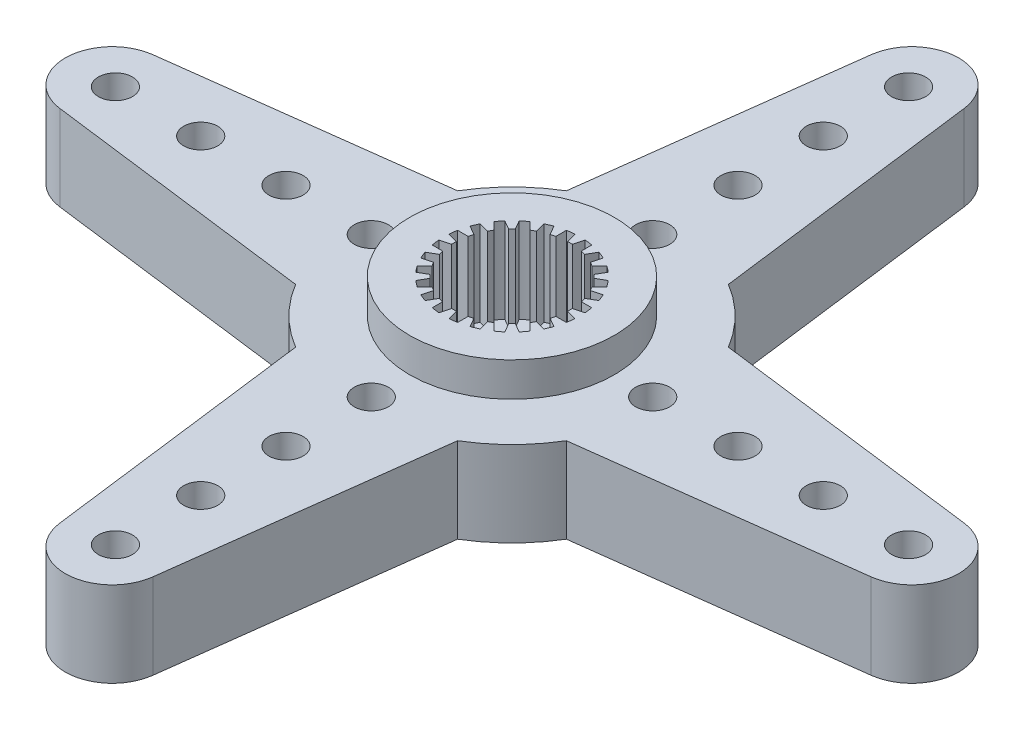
SolidWorks part; units mm, degrees
ref_plane "Plan de face" through (0, 0, 0) normal (0, 0, 1) x (1, 0, 0)
ref_plane "Plan de dessus" through (0, 0, 0) normal (0, 1, 0) x (1, 0, 0)
ref_plane "Plan de droite" through (0, 0, 0) normal (1, 0, 0) x (0, 0, -1)
sketch "Esquisse1" plane through (0, 0, 0) normal (0, 1, 0) x (1, 0, 0)
  circle A0 centre (0, 0) radius 9.25
  circle A1 centre (0, 0) radius 1.65
  dimension "D1" = 18.5
  dimension "D2" = 3.3
extrude "Boss.-Extru.1" add sketch "Esquisse1" along normal blind 8
sketch "Esquisse2" plane through (0, 8, 0) normal (0, 1, 0) x (1, 0, 0)
  line L0 (-4.75, 7.9373) -> (-2.7279, 23.7853)
  line L1 (2.7279, 23.7853) -> (4.75, 7.9373)
  line L2 (4.75, 7.9373) -> (-4.75, 7.9373)
  line L3 (-9.6717, 26.1873) -> (9.6602, 26.1873) construction
  circle A0 centre (0, 0) radius 9.25 construction
  arc A1 (-2.7279, 23.7853) -> (2.7279, 23.7853) centre (0, 23.4373) cw
  dimension "D3" = 2.75
  dimension "D1" = 9.5
  dimension "D2" = 18.25
extrude "Boss.-Extru.2" add sketch "Esquisse2" against normal up to surface (8 mm away)
pattern_circular "Répétition circulaire1" count 4 over 360 about axis through (0, 0, 0) along (0, 1, 0) of "Boss.-Extru.2"
sketch "Esquisse3" plane through (0, 8, 0) normal (0, 1, 0) x (1, 0, 0)
  line L0 (0, 0) -> (0, 17.0578) construction
  circle A0 centre (0, 8.25) radius 1
  dimension "D1" = 2
  dimension "D2" = 8.25
extrude "Enlèv. mat.-Extru.1" cut sketch "Esquisse3" against normal blind 8
pattern_linear "Répétition linéaire1" count 4 spacing 5 along (0, 0, -1) of "Enlèv. mat.-Extru.1"
pattern_circular "Répétition circulaire2" count 4 over 360 about axis through (0, 0, 0) along (0, 1, 0) of "Enlèv. mat.-Extru.1", "Répétition linéaire1"
sketch "Esquisse4" plane through (0, 8, 0) normal (0, 1, 0) x (1, 0, 0)
  line L1 (-37.0652, 32.1232) -> (36.96, 32.1232)
  line L2 (-37.0652, 32.1232) -> (-37.0652, -32.9644)
  line L3 (-37.0652, -32.9644) -> (36.96, -32.9644)
  line L4 (36.96, 32.1232) -> (36.96, -32.9644)
  circle A0 centre (0, 0) radius 6
  dimension "D2" = 12
extrude "Enlèv. mat.-Extru.2" cut sketch "Esquisse4" against normal blind 2
sketch "Esquisse5" plane through (0, 8, 0) normal (0, 1, 0) x (1, 0, 0)
  circle A0 centre (0, 0) radius 4
  dimension "D1" = 8
extrude "Enlèv. mat.-Extru.3" cut sketch "Esquisse5" against normal blind 5
sketch "Esquisse6" plane through (0, 8, 0) normal (0, 1, 0) x (1, 0, 0)
  line L0 (0, 0) -> (0, 6.8792) construction
  line L1 (0, 6.8792) -> (-2.9166, 4) construction
  line L2 (-2.9166, 4) -> (2.5197, 4) construction
  line L3 (-0.3, 4) -> (-0.1392, 3.4)
  line L4 (-0.1392, 3.4) -> (0.1392, 3.4)
  line L5 (0.1392, 3.4) -> (0.3, 4)
  line L6 (0.3, 4) -> (-0.3, 4)
  circle A0 centre (0, 0) radius 4 construction
  point P9 (-0.2117, 3.4)
  point P12 (-0.2005, 3.4)
  dimension "D1" = 0.6
  dimension "D2" = 0.6
  dimension "D3" = 15
extrude "Boss.-Extru.3" add sketch "Esquisse6" against normal up to surface (5 mm away)
pattern_circular "Répétition circulaire3" count 24 over 360 about axis through (0, 0, 0) along (0, 1, 0) of "Boss.-Extru.3"
sketch "Esquisse7" plane through (0, 0, 0) normal (0, -1, 0) x (1, 0, 0)
  circle A0 centre (0, 0) radius 4.5
  circle A1 centre (0, 0) radius 34.023
  dimension "D1" = 9
extrude "Enlèv. mat.-Extru.4" cut sketch "Esquisse7" against normal blind 1
sketch "Esquisse8" plane through (0, 0, 0) normal (0, -1, 0) x (1, 0, 0)
  circle A0 centre (0, 0) radius 2.75
  dimension "D1" = 5.5
extrude "Enlèv. mat.-Extru.5" cut sketch "Esquisse8" against normal blind 1
chamfer "Chanfrein1" distance 1 angle 45 1 edges at (0, 1, -4.5)
